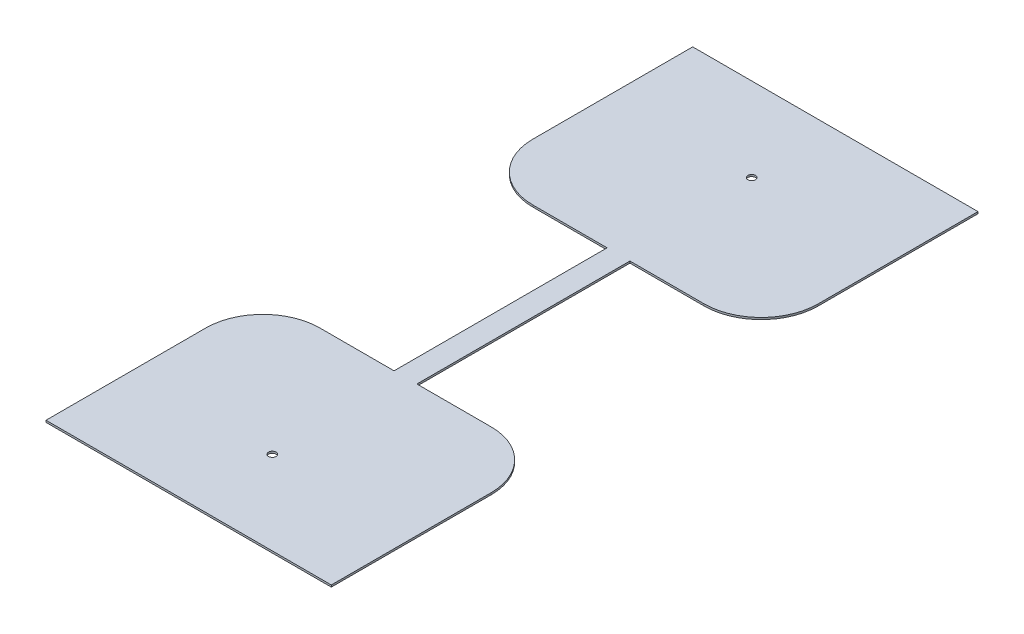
SolidWorks part; units mm, degrees
ref_plane "Front Plane" through (0, 0, 0) normal (0, 0, 1) x (1, 0, 0)
ref_plane "Top Plane" through (0, 0, 0) normal (0, 1, 0) x (1, 0, 0)
ref_plane "Right Plane" through (0, 0, 0) normal (1, 0, 0) x (0, 0, -1)
sketch "Эскиз1" plane through (0, 0, 0) normal (0, 1, 0) x (1, 0, 0)
  line L0 (0, 0) -> (0, 744.4874) construction
  line L1 (-1040.6633, 0) -> (1163.0706, 0) construction
  line L2 (0, 0) -> (0, -193.0836) construction
  line L3 (-3, 28) -> (-3, -28)
  line L4 (-37.5, 85) -> (37.5, 85)
  line L5 (-37.5, 85) -> (-37.5, 43)
  line L6 (-22.5, 28) -> (-3, 28)
  line L7 (22.5, 28) -> (3, 28)
  line L8 (37.5, 85) -> (37.5, 43)
  line L9 (3, 28) -> (3, -28)
  line L10 (37.5, -85) -> (37.5, -43)
  line L11 (22.5, -28) -> (3, -28)
  line L12 (-22.5, -28) -> (-3, -28)
  line L13 (-37.5, -85) -> (-37.5, -43)
  line L14 (-37.5, -85) -> (37.5, -85)
  arc A0 (-37.5, 43) -> (-22.5, 28) centre (-22.5, 43) ccw
  arc A1 (37.5, 43) -> (22.5, 28) centre (22.5, 43) cw
  arc A2 (37.5, -43) -> (22.5, -28) centre (22.5, -43) ccw
  arc A3 (-37.5, -43) -> (-22.5, -28) centre (-22.5, -43) cw
  circle A4 centre (0, 63) radius 1
  circle A5 centre (0, -63) radius 1
  point P6 (0, 0)
  point P19 (0, 85)
  point P28 (3, 0)
  point P31 (-3, 0)
  point P32 (0, -85)
  dimension "D4" = 15
  dimension "D6" = 2
  dimension "D1" = 37.5
  dimension "D2" = 57
  dimension "D3" = 28
  dimension "D5" = 3
  dimension "D7" = 22
extrude "Бобышка-Вытянуть1" add sketch "Эскиз1" along normal blind 0.5
